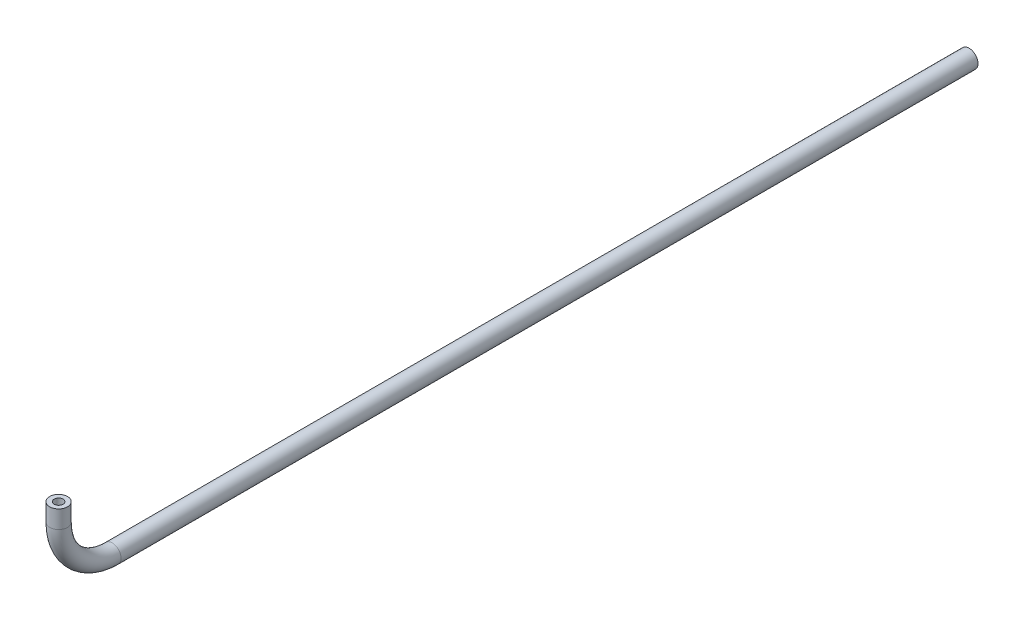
SolidWorks part; units mm, degrees
ref_plane "Front Plane" through (0, 0, 0) normal (0, 0, 1) x (1, 0, 0)
ref_plane "Top Plane" through (0, 0, 0) normal (0, 1, 0) x (1, 0, 0)
ref_plane "Right Plane" through (0, 0, 0) normal (1, 0, 0) x (0, 0, -1)
sketch "Sketch1" plane through (0, 0, 0) normal (0, 1, 0) x (1, 0, 0)
  circle A0 centre (0, 0) radius 0.7937
  circle A1 centre (0, 0) radius 0.3969
  dimension "D1" = 1.5875
  dimension "D2" = 0.7937
sketch "Sketch2" plane through (0, 0, 0) normal (1, 0, 0) x (0, 0, -1)
  line L0 (0, 0) -> (0, -1.5875)
  line L1 (4.7625, -6.35) -> (80.9625, -6.35)
  arc A0 (0, -1.5875) -> (4.7625, -6.35) centre (4.7625, -1.5875) ccw
  dimension "D1" = 4.7625
  dimension "D2" = 1.5875
  dimension "D3" = 90
  dimension "D4" = 76.2
sweep "Sweep1" add profiles "Sketch1" path "Sketch2"
